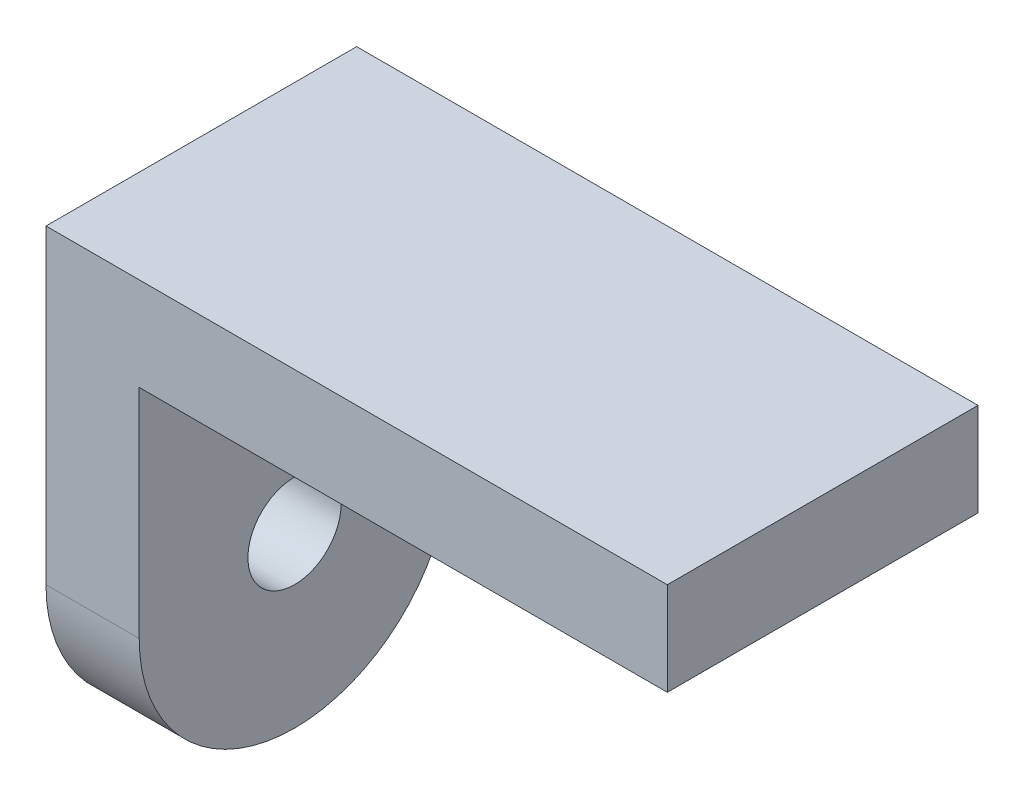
SolidWorks part; units mm, degrees
ref_plane "Plan de face" through (0, 0, 0) normal (0, 0, 1) x (1, 0, 0)
ref_plane "Plan de dessus" through (0, 0, 0) normal (0, 1, 0) x (1, 0, 0)
ref_plane "Plan de droite" through (0, 0, 0) normal (1, 0, 0) x (0, 0, -1)
sketch "Esquisse1" plane through (0, 0, 0) normal (0, 0, 1) x (1, 0, 0)
  line L0 (0, 0) -> (0, 15)
  line L1 (0, 15) -> (20, 15)
extrude "Extru.-Mince1" add sketch "Esquisse1" along normal blind 10 thin
sketch "Esquisse2" plane through (3, 0, 0) normal (1, 0, 0) x (0, 0, -1)
  circle A0 centre (-5, 5.5) radius 1.5
extrude "Extrusion1" cut sketch "Esquisse2" against normal blind 15
fillet "Congé1" radius 5 1 edges at (1.5, 0, 10)
fillet "Congé2" radius 5 1 edges at (1.5, 0, 0)
